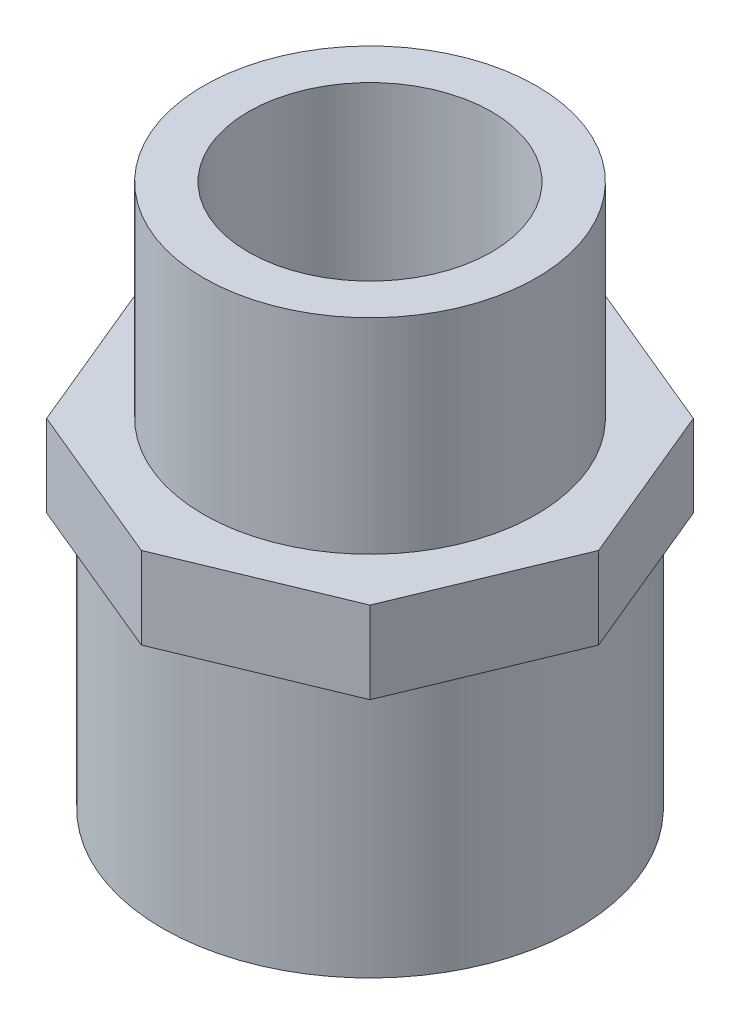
SolidWorks part; units mm, degrees
ref_plane "Front Plane" through (0, 0, 0) normal (0, 0, 1) x (1, 0, 0)
ref_plane "Top Plane" through (0, 0, 0) normal (0, 1, 0) x (1, 0, 0)
ref_plane "Right Plane" through (0, 0, 0) normal (1, 0, 0) x (0, 0, -1)
sketch "Sketch1" plane through (0, 0, 0) normal (0, 1, 0) x (1, 0, 0)
  line L1 (22.6815, 0) -> (16.0383, 16.0383)
  line L2 (16.0383, 16.0383) -> (0, 22.6815)
  line L3 (0, 22.6815) -> (-16.0383, 16.0383)
  line L4 (-16.0383, 16.0383) -> (-22.6815, 0)
  line L5 (-22.6815, 0) -> (-16.0383, -16.0383)
  line L6 (-16.0383, -16.0383) -> (0, -22.6815)
  line L7 (0, -22.6815) -> (16.0383, -16.0383)
  line L8 (16.0383, -16.0383) -> (22.6815, 0)
  circle A0 centre (0, 0) radius 20.955 construction
  circle A1 centre (0, 0) radius 12.065
  dimension "D1" = 41.91
  dimension "D2" = 24.13
extrude "Boss-Extrude1" add sketch "Sketch1" along normal blind 8.128
sketch "Sketch2" plane through (0, 0, 0) normal (0, -1, 0) x (1, 0, 0)
  circle A0 centre (0, 0) radius 16.637
  circle A1 centre (0, 0) radius 20.574
  dimension "D1" = 41.148
  dimension "D2" = 33.274
extrude "Boss-Extrude2" add sketch "Sketch2" along normal blind 25.4
sketch "Sketch3" plane through (0, 8.128, 0) normal (0, 1, 0) x (1, 0, 0)
  circle A0 centre (0, 0) radius 12.065
  circle A1 centre (0, 0) radius 16.51
  dimension "D1" = 33.02
  dimension "D2" = 24.13
extrude "Boss-Extrude3" add sketch "Sketch3" along normal blind 20.32
